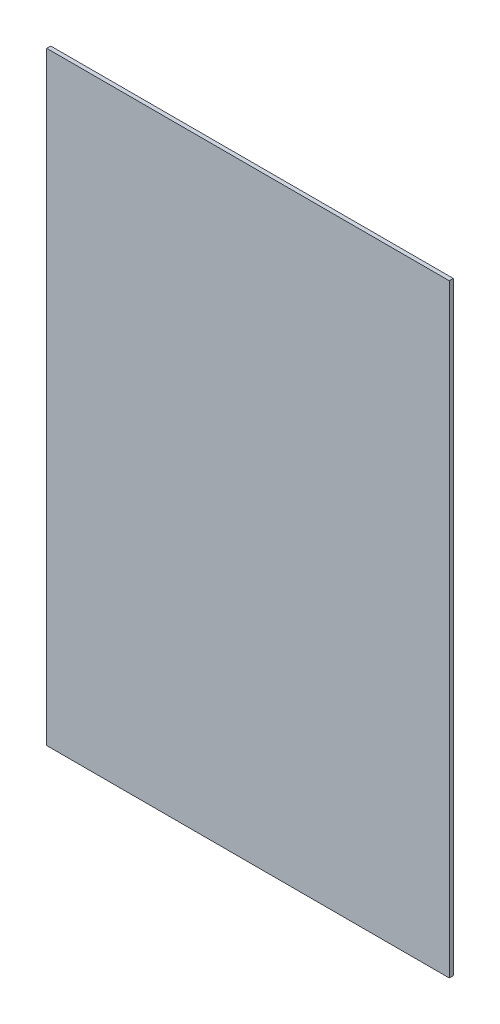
SolidWorks part; units mm, degrees
ref_plane "Ebene vorne" through (0, 0, 0) normal (0, 0, 1) x (1, 0, 0)
ref_plane "Ebene oben" through (0, 0, 0) normal (0, 1, 0) x (1, 0, 0)
ref_plane "Ebene rechts" through (0, 0, 0) normal (1, 0, 0) x (0, 0, -1)
sketch "Skizze1" plane through (0, 0, 0) normal (0, 0, 1) x (1, 0, 0)
  line L1 (-124.4884, 1255.9205) -> (675.5116, 1255.9205)
  line L2 (-124.4884, 1255.9205) -> (-124.4884, 55.9205)
  line L3 (-124.4884, 55.9205) -> (675.5116, 55.9205)
  line L4 (675.5116, 1255.9205) -> (675.5116, 55.9205)
  dimension "D1" = 1200
  dimension "D2" = 800
extrude "Aufsatz-Linear austragen1" add sketch "Skizze1" along normal blind 8
